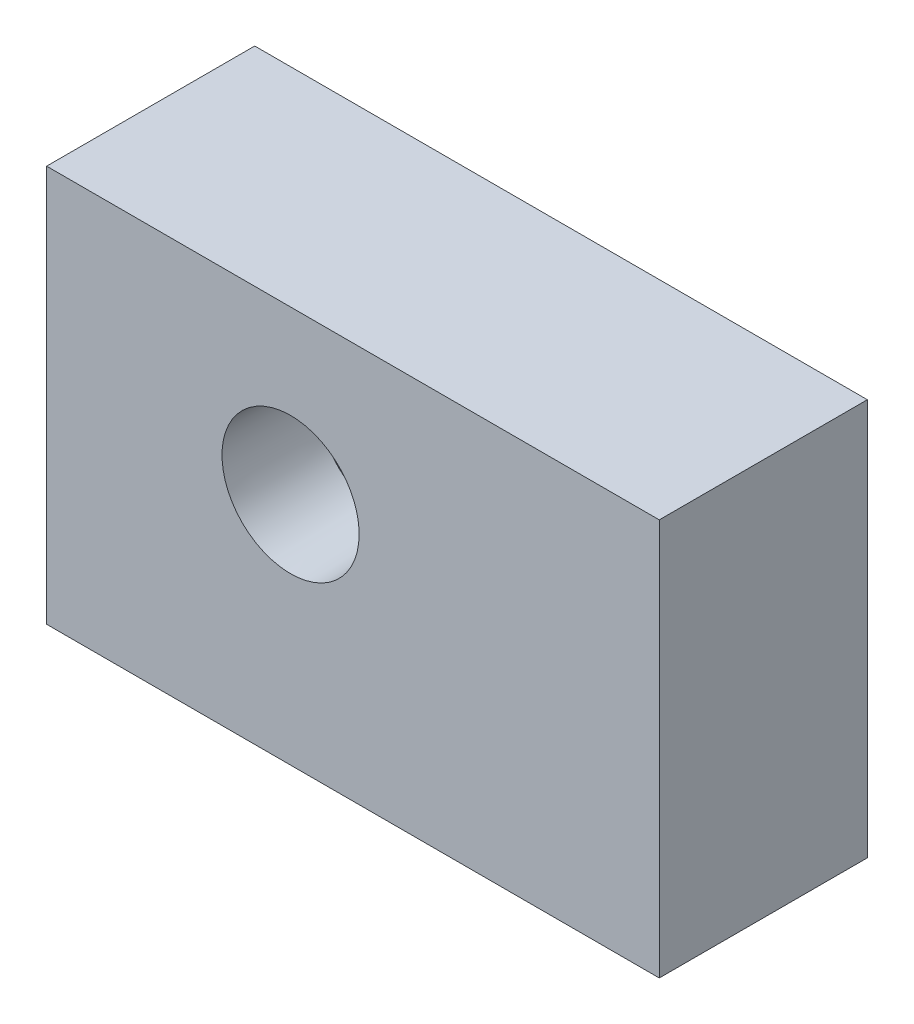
SolidWorks part; units mm, degrees
ref_plane "Vorne" through (0, 0, 0) normal (0, 0, 1) x (1, 0, 0)
ref_plane "Oben" through (0, 0, 0) normal (0, 1, 0) x (1, 0, 0)
ref_plane "Rechts" through (0, 0, 0) normal (1, 0, 0) x (0, 0, -1)
sketch "Skizze1" plane through (0, 0, 0) normal (0, 0, 1) x (1, 0, 0)
  line L1 (0, 0) -> (88.3203, 0)
  line L2 (0, 0) -> (0, 57.1994)
  line L3 (0, 57.1994) -> (88.3203, 57.1994)
  line L4 (88.3203, 0) -> (88.3203, 57.1994)
extrude "Linear austragen1" add sketch "Skizze1" along normal blind 30
hole_wizard "1/2 NPT Gewindebohrung1" positions "Skizze3" profile "Skizze2" size "1/2" standard "Ansi Zoll"
sketch "Skizze3" plane through (0, 0, 30) normal (0, 0, 1) x (1, 0, 0)
  point P0 (35.1675, 33.7813)
sketch "Skizze2" plane through (35.1675, 33.7813, 30) normal (1, 0, 0) x (0, -1, 0)
  line L0 (0, 0) -> (0, 28.0035)
  line L1 (8.9281, 22.639) -> (0, 28.0035)
  line L2 (-8.9281, 22.639) -> (0, 28.0035) construction
  line L3 (8.9281, 22.639) -> (8.9281, 13.5712)
  line L4 (8.9281, 13.5712) -> (9.4797, 13.5712)
  line L5 (9.4797, 13.5712) -> (9.8861, 0)
  line L6 (-9.4797, 13.5712) -> (-9.8861, 0) construction
  line L7 (9.8861, 0) -> (0, 0)
  line L8 (0, -6.35) -> (0, 107.95) construction
  line L11 (-8.9281, 13.5712) -> (-9.4797, 13.5712) construction
  dimension "Bohrerdurchmesser" = 17.8562
  dimension "Bohrungstiefe" = 22.639
  dimension "Kegeldurchmesser" = 19.7721
  dimension "Kegelwinkel" = 3.43
  dimension "Gewindelänge" = 13.5712
  dimension "Spitzenwinkel" = 118
